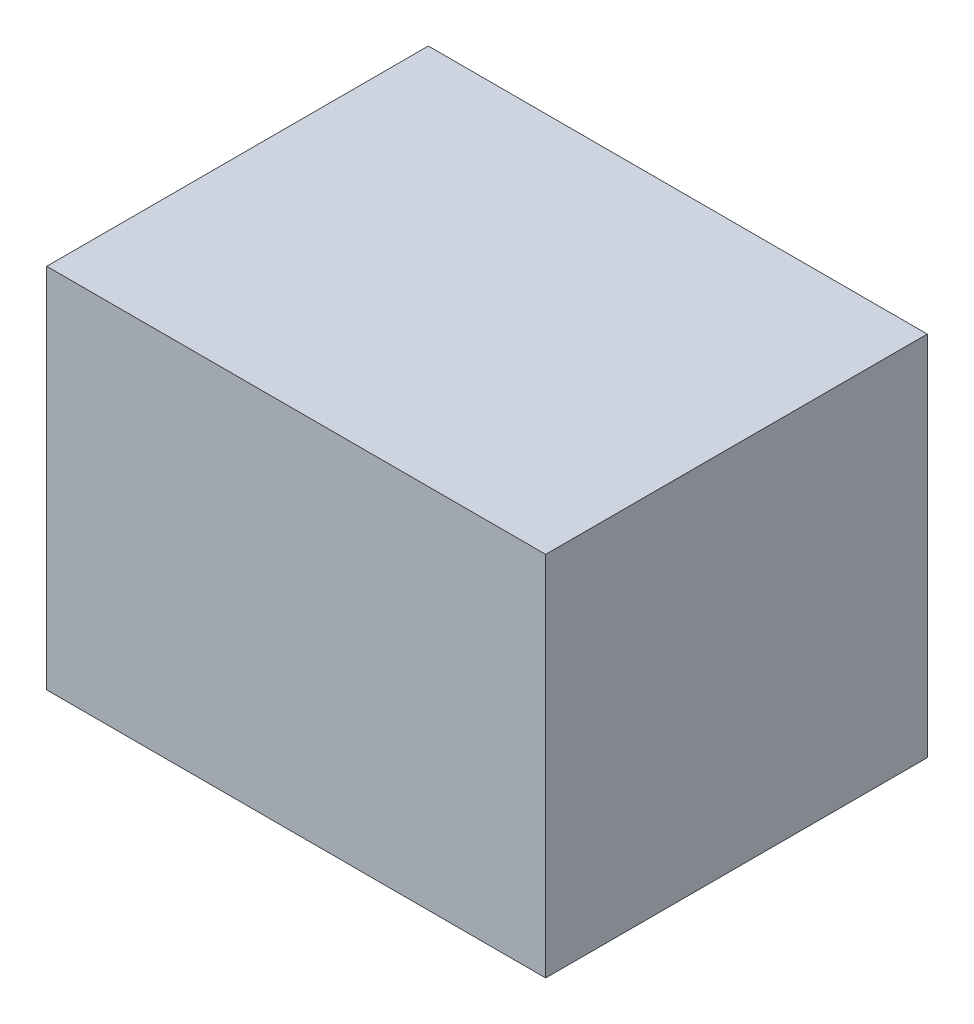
SolidWorks part; units mm, degrees
ref_plane "前视基准面" through (0, 0, 0) normal (0, 0, 1) x (1, 0, 0)
ref_plane "上视基准面" through (0, 0, 0) normal (0, 1, 0) x (1, 0, 0)
ref_plane "右视基准面" through (0, 0, 0) normal (1, 0, 0) x (0, 0, -1)
sketch "草图1" plane through (0, 0, 0) normal (0, 1, 0) x (1, 0, 0)
  line L0 (0, 0) -> (-68, 0)
  line L1 (-68, 0) -> (-68, -52)
  line L2 (-68, -52) -> (0, -52)
  line L3 (0, -52) -> (0, 0)
  dimension "D1" = 68
  dimension "D2" = 52
extrude "凸台-拉伸1" add sketch "草图1" along normal blind 50
sketch "草图2" plane through (0, 0, 0) normal (0, 0, 1) x (1, 0, 0)
  line L0 (-24, 50) -> (-68, 14)
  line L1 (-68, 50) -> (0, 50) construction
  line L2 (-68, 50) -> (-68, 0) construction
  line L3 (-68, 14) -> (-68, 50)
  line L4 (-68, 50) -> (-24, 50)
  dimension "D1" = 24
  dimension "D2" = 14
